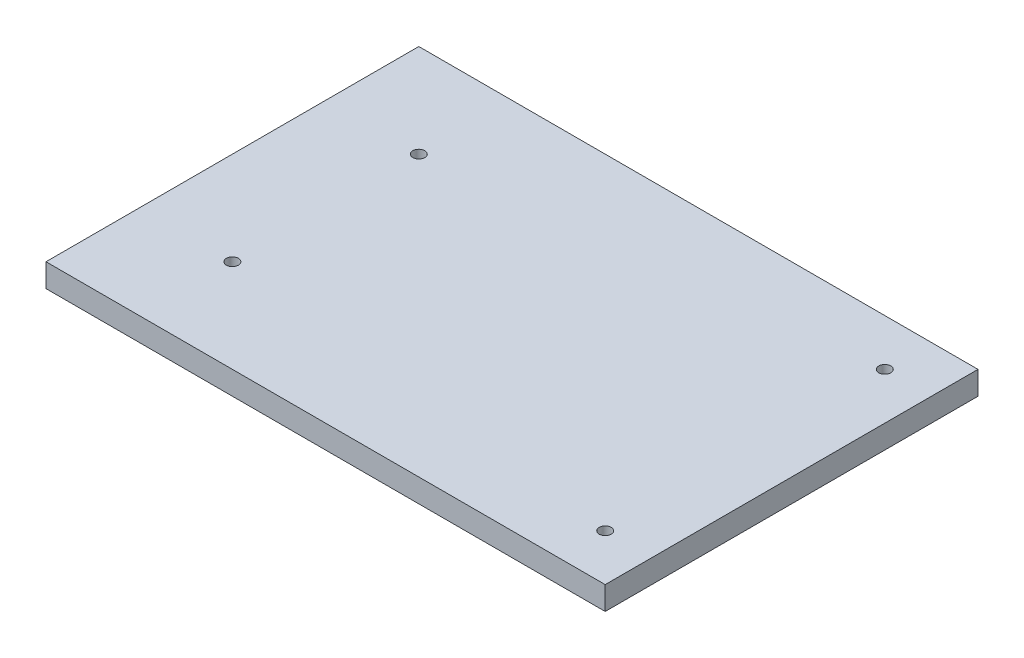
SolidWorks part; units mm, degrees
ref_plane "Front Plane" through (0, 0, 0) normal (0, 0, 1) x (1, 0, 0)
ref_plane "Top Plane" through (0, 0, 0) normal (0, 1, 0) x (1, 0, 0)
ref_plane "Right Plane" through (0, 0, 0) normal (1, 0, 0) x (0, 0, -1)
sketch "Sketch1" plane through (0, 0, 0) normal (0, 1, 0) x (1, 0, 0)
  line L1 (-168.1814, 43.9097) -> (-15.7814, 43.9097)
  line L2 (-168.1814, 43.9097) -> (-168.1814, -57.6903)
  line L3 (-168.1814, -57.6903) -> (-15.7814, -57.6903)
  line L4 (-15.7814, 43.9097) -> (-15.7814, -57.6903)
  dimension "D1" = 152.4
  dimension "D2" = 101.6
extrude "Extrude1" add sketch "Sketch1" along normal blind 6.35
hole_wizard "#4 Clearance Hole1" positions "Sketch3" profile "Sketch4" hole size "#4" standard "Ansi Inch"
sketch "Sketch3" plane through (0, 6.35, 0) normal (0, 1, 0) x (-1, 0, 0)
  line L0 (168.1814, -43.9097) -> (168.1814, 57.6903) construction
  line L1 (168.1814, 57.6903) -> (15.7814, 57.6903) construction
  line L3 (15.7814, -43.9097) -> (168.1814, -43.9097) construction
  line L4 (15.7814, 57.6903) -> (15.7814, -43.9097) construction
  point P0 (142.7814, -18.5097)
  point P1 (142.7814, 32.2903)
  point P3 (28.4814, 44.9903)
  point P5 (28.4814, -31.2097)
  dimension "D1" = 25.4
  dimension "D2" = 25.4
  dimension "D3" = 25.4
  dimension "D4" = 25.4
  dimension "D5" = 12.7
  dimension "D6" = 12.7
  dimension "D7" = 12.7
  dimension "D8" = 12.7
sketch "Sketch4" plane through (-142.7814, 6.35, -18.5097) normal (1, 0, 0) x (0, 0, 1)
  line L0 (0, 0) -> (0, 10.8866)
  line L1 (0, 10.8866) -> (1.6319, 9.906)
  line L2 (1.6319, 9.906) -> (1.6319, 0)
  line L5 (1.6319, 0) -> (0, 0)
  line L10 (0, 10.8866) -> (-1.6319, 9.906) construction
  line L11 (0, -6.35) -> (0, 107.95) construction
  dimension "Hole Dia." = 3.2639
  dimension "Hole Depth" = 9.906
  dimension "Drill Angle" = 118
